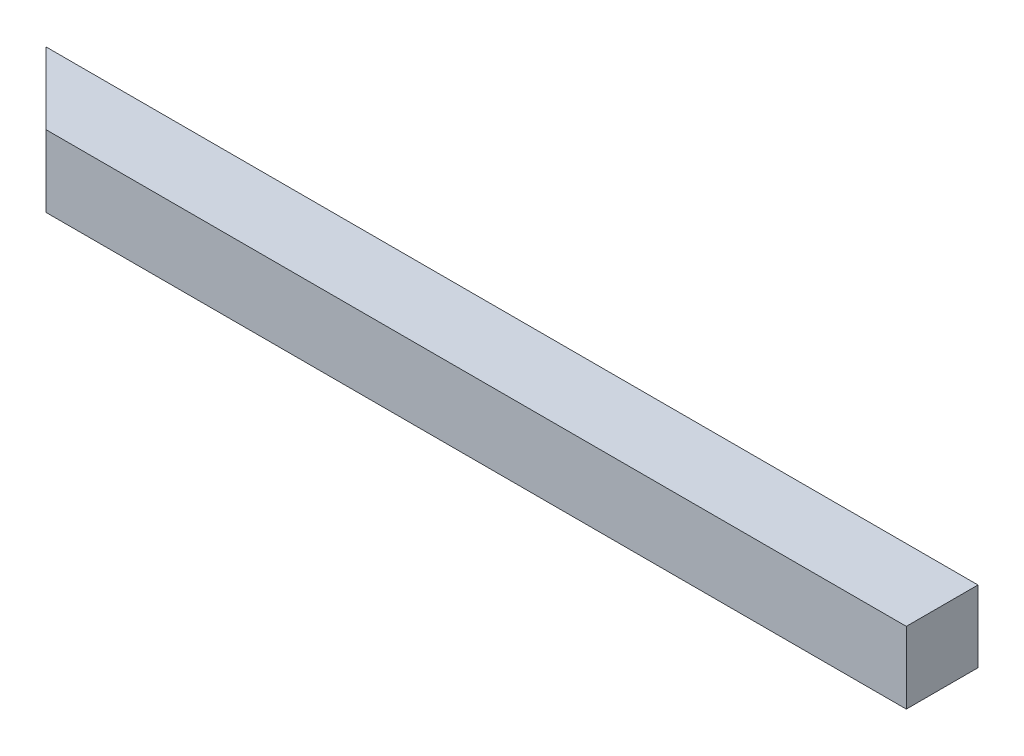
SolidWorks part; units mm, degrees
ref_plane "Front Plane" through (0, 0, 0) normal (0, 0, 1) x (1, 0, 0)
ref_plane "Top Plane" through (0, 0, 0) normal (0, 1, 0) x (1, 0, 0)
ref_plane "Right Plane" through (0, 0, 0) normal (1, 0, 0) x (0, 0, -1)
sketch "Sketch1" plane through (0, 0, 0) normal (0, 1, 0) x (1, 0, 0)
  line L0 (-120, 10) -> (-140, 10)
  line L1 (-120, 10) -> (120, 10)
  line L3 (-120, -10) -> (120, -10)
  line L4 (120, 10) -> (120, -10)
  line L5 (-120, 10) -> (120, -10) construction
  line L6 (-120, -10) -> (120, 10) construction
  line L7 (-120, -10) -> (-140, 10)
  point P0 (0, 0)
  dimension "D1" = 240
  dimension "D2" = 20
extrude "Boss-Extrude1" add sketch "Sketch1" along normal blind 20
